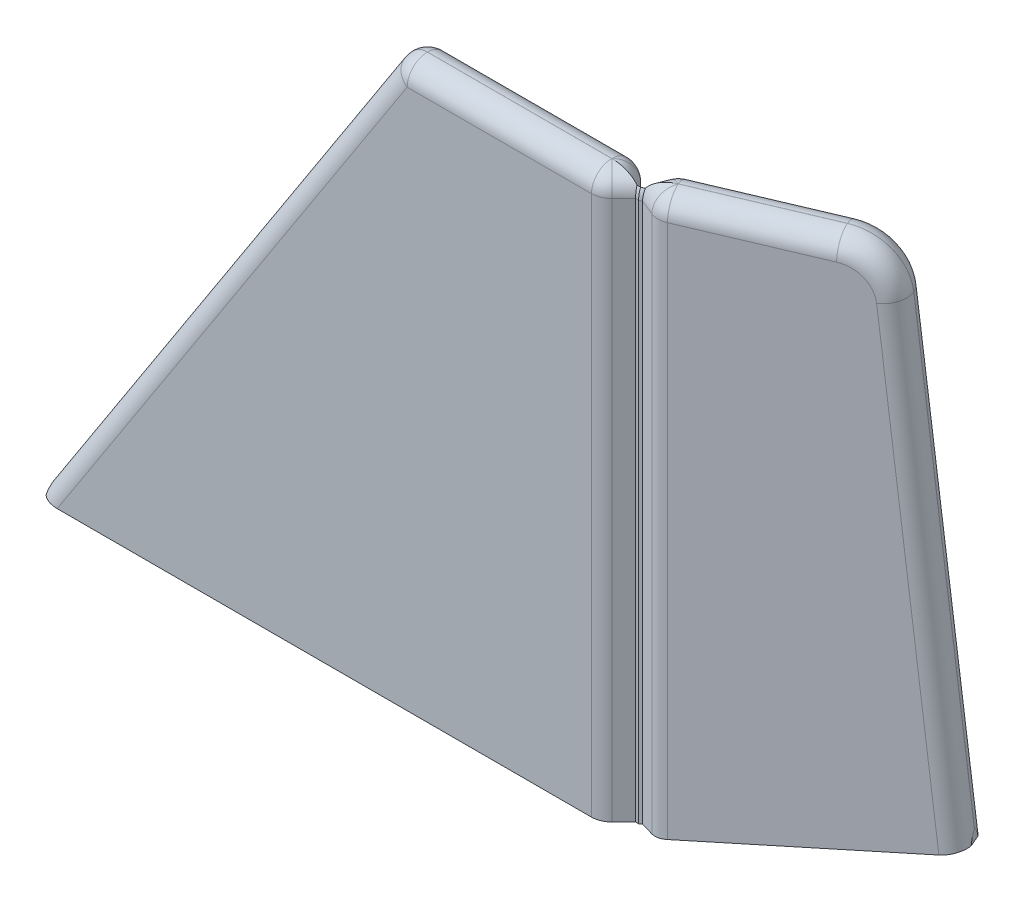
SolidWorks part; units mm, degrees
ref_plane "Plan de face" through (0, 0, 0) normal (0, 0, 1) x (1, 0, 0)
ref_plane "Plan de dessus" through (0, 0, 0) normal (0, 1, 0) x (1, 0, 0)
ref_plane "Plan de droite" through (0, 0, 0) normal (1, 0, 0) x (0, 0, -1)
sketch "Esquisse1" plane through (0, 0, 0) normal (0, 1, 0) x (1, 0, 0)
  line L0 (-66.7162, 0) -> (100.1965, 0) construction
  line L1 (0, -23.9494) -> (0, 66.7162) construction
  line L2 (-57, -25.2419) -> (-57, 46.6455) construction
  line L3 (0, 0) -> (41.9034, 17.787) construction
  line L4 (17.2106, 23.4369) -> (32.8573, -13.4244) construction
  line L5 (8.1991, -19.3158) -> (0, 0) construction
  line L6 (-61.3571, -2) -> (-0.9216, -2) construction
  line L7 (36.5036, 13.3221) -> (1.4959, -1.5377) construction
  line L8 (-61.3571, 2) -> (-0.9216, 2) construction
  line L9 (0.3188, 2.3081) -> (35.6525, 17.3063) construction
  line L10 (1.0043, 0.6979) -> (-0.0509, 0.25) construction
  line L11 (1.3069, 0.2831) -> (0.0509, -0.25) construction
  line L12 (-2.3707, 0.25) -> (-0.0509, 0.25) construction
  line L13 (-2.3707, -0.25) -> (0.0509, -0.25) construction
  line L14 (0.8641, -1.3958) -> (-0.1421, 0.9746) construction
  line L15 (-0.25, -0.25) -> (-2.4272, -2.4272) construction
  line L16 (-0.25, 0.4022) -> (-0.25, -0.7324) construction
  line L17 (0.3278, -0.1324) -> (3.0113, -1.2166) construction
  line L18 (2.6225, -1.0595) -> (0.3278, -0.1324)
  line L19 (0.3278, -0.1324) -> (0.0509, -0.25)
  line L20 (1.0595, 2.6225) -> (0.1324, 0.3278)
  line L21 (-0.25, -0.25) -> (-2, -2)
  line L22 (-0.25, 0.25) -> (-2, 2)
  line L23 (-0.25, -0.25) -> (0.0509, -0.25)
  line L24 (-0.25, 0.25) -> (-0.0509, 0.25)
  line L25 (-0.0509, 0.25) -> (0.1324, 0.3278)
  line L26 (1.0595, 2.6225) -> (22.2312, 11.6093)
  line L27 (22.2312, 11.6093) -> (23.7941, 7.9273)
  line L28 (23.7941, 7.9273) -> (2.6225, -1.0595)
  line L29 (-2, -2) -> (-57, -2)
  line L30 (-57, -2) -> (-57, 2)
  line L31 (-57, 2) -> (-2, 2)
  dimension "D1" = 157
  dimension "D2" = 57
  dimension "D3" = 0.5
  dimension "D4" = 2
  dimension "D5" = 4
  dimension "D6" = 2
  dimension "D7" = 0.5
  dimension "D8" = 0.25
  dimension "D9" = 0.25
  dimension "D10" = 0.25
  dimension "D11" = 0.25
  dimension "D12" = 45
  dimension "D13" = 45
extrude "Boss.-Extru.1" add sketch "Esquisse1" along normal blind 60
sketch "Esquisse2" plane through (0, 0, 2) normal (0, 0, 1) x (1, 0, 0)
  line L0 (-62.5371, 0) -> (29.8808, 0) construction
  line L1 (-62.5371, 5) -> (29.8808, 5) construction
  line L2 (0.3278, -6.0997) -> (0.3278, 63.9991) construction
  line L3 (-63.1652, 60) -> (29.8808, 60) construction
  line L4 (-57, 62.9783) -> (-57, -6.0997) construction
  line L5 (-22, 62.9783) -> (-22, 35.4964) construction
  line L7 (-57, 5) -> (0.3278, 5)
  line L8 (-62.5371, 6) -> (-55.1348, 6) construction
  line L9 (-57, 5) -> (-57, 0)
  line L10 (-57, 0) -> (0.3278, 0)
  line L11 (0.3278, 5) -> (0.3278, 0)
  line L17 (-57, 6) -> (-22, 60)
  line L18 (-22, 60) -> (-57, 60)
  line L19 (-57, 60) -> (-57, 6)
  dimension "D1" = 5
  dimension "D2" = 35
  dimension "D5" = 1
extrude "Enlèv. mat.-Extru.1" cut sketch "Esquisse2" against normal blind 4
sketch "Esquisse3" plane through (0.7815, 0, 1.841) normal (0.3907, 0, 0.9205) x (0.9205, 0, -0.3907)
  line L0 (25, 0) -> (25, 10)
  line L1 (0, -3.7736) -> (0, 7.276) construction
  line L2 (26.9814, 5) -> (-1.4622, 5) construction
  line L3 (25, -2.8857) -> (25, 63.4494) construction
  line L4 (0, 0) -> (0, 5)
  line L5 (25, 10) -> (0, 5)
  line L6 (25, 0) -> (0, 0)
  line L7 (28.7866, 60) -> (-1.4622, 60) construction
  line L8 (20, 63.4494) -> (20, 45.9437) construction
  line L9 (26.9814, 10) -> (-5.4744, 10) construction
  line L10 (25, 60) -> (25, 0) construction
  line L11 (25, 11) -> (20, 60)
  line L12 (20, 60) -> (25, 60)
  line L13 (25, 60) -> (25, 11)
  line L14 (26.9814, 11) -> (18.447, 11) construction
  dimension "D2" = 1
  dimension "D3" = 5
  dimension "D4" = 5
extrude "Enlèv. mat.-Extru.2" cut sketch "Esquisse3" against normal blind 4
fillet "Congé1" radius 5 1 edges at (18.4101, 60, -7.8146)
fillet "Congé2" radius 1.99 23 edges at (20.1409, 33.2538, -10.722) (16.5567, 58.7106, -9.2006) (18.1197, 58.7106, -5.5186) (1.4751, 60, 0.596) (0.1893, 60, 0.1912) (-0.0996, 60, 0.25) (-1.125, 60, 1.125) (-12, 60, 2) (-22, 60, 0) (-12, 60, -2) (-1.125, 60, -1.125) (-0.1504, 60, -0.25) (0.0408, 60, -0.2889) (0.596, 60, -1.4751) (7.2657, 60, -5.2568) (8.8286, 60, -1.5748) (1.0595, 32.7, -2.6225) (-2, 32.5, -2) (-39.5, 33, -2) (2.6225, 32.7, 1.0595) (-2, 32.5, 2) (-39.5, 33, 2) (21.7038, 33.2538, -7.04)
